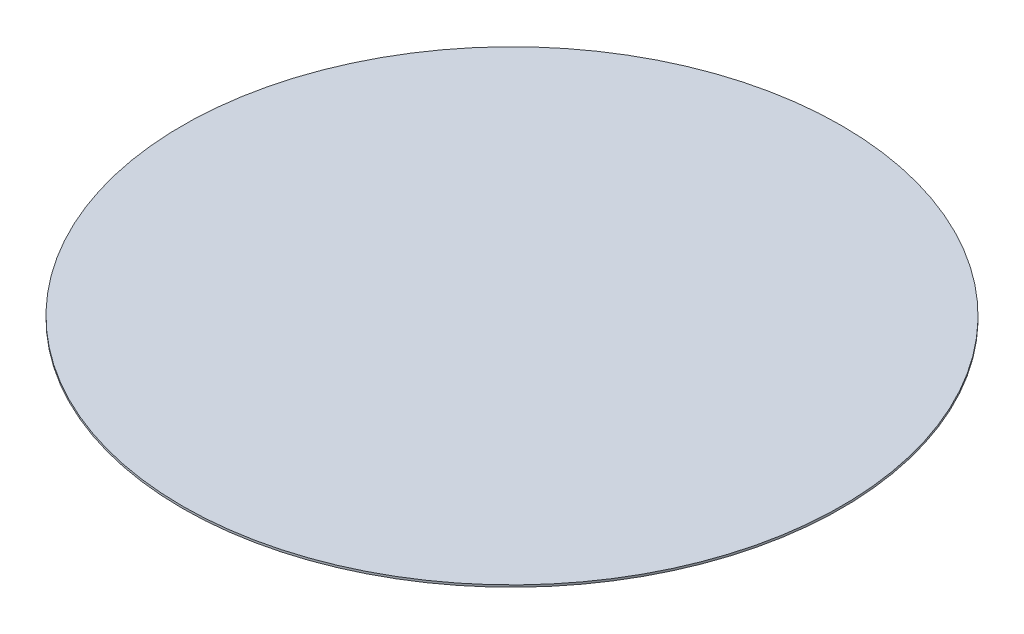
SolidWorks part; units mm, degrees
ref_plane "Plan1" through (0, 0, 0) normal (0, 0, 1) x (1, 0, 0)
ref_plane "Plan2" through (0, 0, 0) normal (0, 1, 0) x (1, 0, 0)
ref_plane "Plan3" through (0, 0, 0) normal (1, 0, 0) x (0, 0, -1)
sketch "Esquisse1" plane through (0, 0, 0) normal (0, 1, 0) x (1, 0, 0)
  circle A0 centre (0, 0) radius 8
  dimension "D1" = 16
extrude "Boss.-Extru.1" add sketch "Esquisse1" along normal blind 0.05
